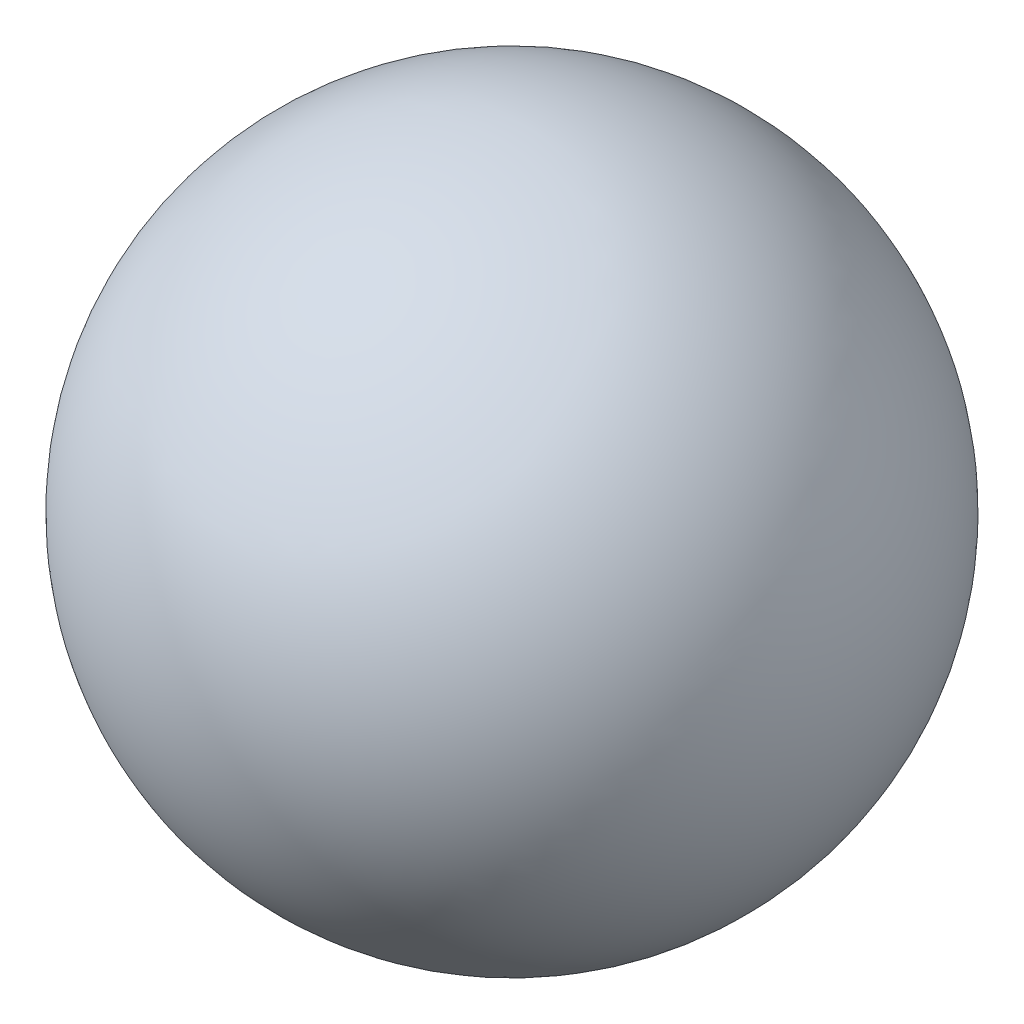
SolidWorks part; units mm, degrees
ref_plane "Alzado" through (0, 0, 0) normal (0, 0, 1) x (1, 0, 0)
ref_plane "Planta" through (0, 0, 0) normal (0, 1, 0) x (1, 0, 0)
ref_plane "Vista lateral" through (0, 0, 0) normal (1, 0, 0) x (0, 0, -1)
sketch "Croquis1" plane through (0, 0, 0) normal (1, 0, 0) x (0, 0, -1)
  line L0 (0, 0) -> (140, 0)
  arc A0 (140, 0) -> (0, 0) centre (70, 0) ccw
  dimension "D1" = 140
revolve "Revolución1" add sketch "Croquis1" angle 360 about L0
